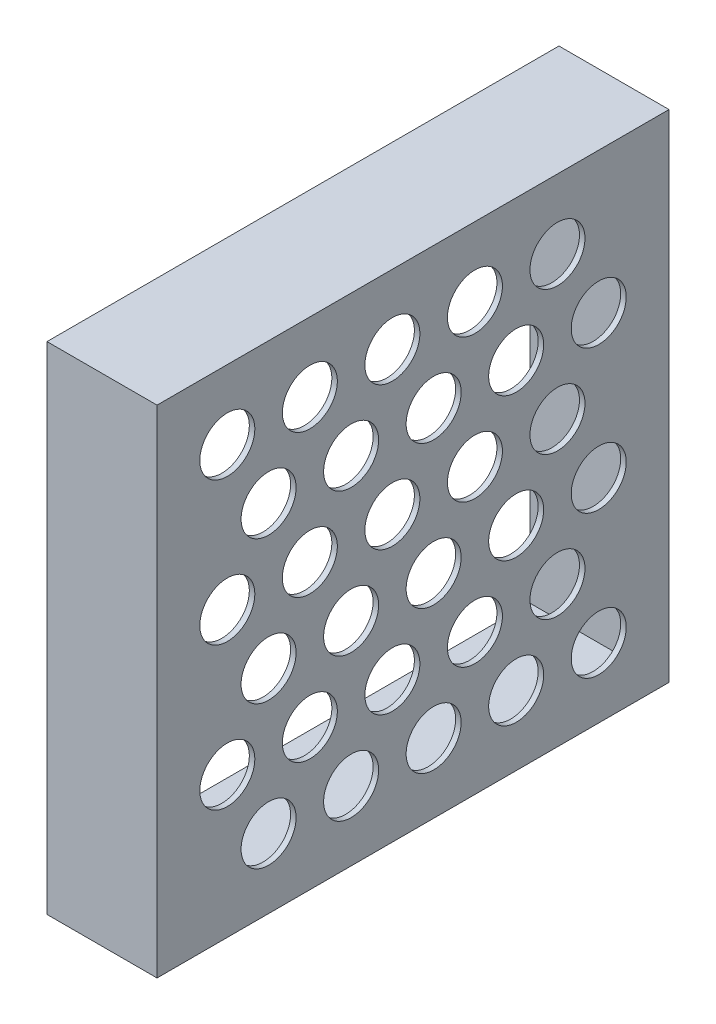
SolidWorks part; units mm, degrees
ref_plane "Front Plane" through (0, 0, 0) normal (0, 0, 1) x (1, 0, 0)
ref_plane "Top Plane" through (0, 0, 0) normal (0, 1, 0) x (1, 0, 0)
ref_plane "Right Plane" through (0, 0, 0) normal (1, 0, 0) x (0, 0, -1)
sketch "Sketch2" plane through (0, 0, 0) normal (1, 0, 0) x (0, 0, -1)
  line L6 (-37.5, 297.3) -> (375, 297.3)
  line L9 (-37.5, 297.3) -> (-37.5, -102.4519)
  line L12 (-37.5, -102.4519) -> (375, -102.4519)
  line L13 (375, 297.3) -> (375, -102.4519)
  line L25 (25, 519.6) -> (50, 519.6)
  line L26 (100, 519.6) -> (125, 519.6)
  line L27 (175, 519.6) -> (200, 519.6)
  line L28 (250, 519.6) -> (275, 519.6)
  line L29 (325, 519.6) -> (350, 519.6)
  line L30 (325, 389.7) -> (350, 389.7)
  line L31 (250, 389.7) -> (275, 389.7)
  line L32 (175, 389.7) -> (200, 389.7)
  line L33 (100, 389.7) -> (125, 389.7)
  line L34 (25, 389.7) -> (50, 389.7)
  line L35 (25, 259.8) -> (50, 259.8)
  line L36 (100, 259.8) -> (125, 259.8)
  line L37 (175, 259.8) -> (200, 259.8)
  line L38 (250, 259.8) -> (275, 259.8)
  line L39 (325, 259.8) -> (350, 259.8)
  line L40 (25, 129.9) -> (50, 129.9)
  line L41 (100, 129.9) -> (125, 129.9)
  line L42 (175, 129.9) -> (200, 129.9)
  line L43 (250, 129.9) -> (275, 129.9)
  line L44 (325, 129.9) -> (350, 129.9)
  line L45 (25, 0) -> (50, 0)
  line L46 (100, 0) -> (125, 0)
  line L47 (175, 0) -> (200, 0)
  line L48 (250, 0) -> (275, 0)
  line L49 (325, 0) -> (350, 0)
  circle A0 centre (0, 0) radius 25
  circle A1 centre (75, 0) radius 25
  circle A2 centre (150, 0) radius 25
  circle A3 centre (225, 0) radius 25
  circle A4 centre (300, 0) radius 25
  circle A5 centre (37.5, -64.9519) radius 25
  circle A6 centre (112.5, -64.9519) radius 25
  circle A7 centre (187.5, -64.9519) radius 25
  circle A8 centre (262.5, -64.9519) radius 25
  circle A9 centre (337.5, -64.9519) radius 25
  circle A10 centre (37.5, 64.9481) radius 25
  circle A11 centre (112.5, 64.9481) radius 25
  circle A12 centre (187.5, 64.9481) radius 25
  circle A13 centre (262.5, 64.9481) radius 25
  circle A14 centre (337.5, 64.9481) radius 25
  circle A15 centre (37.5, 194.8481) radius 25
  circle A16 centre (112.5, 194.8481) radius 25
  circle A17 centre (187.5, 194.8481) radius 25
  circle A18 centre (262.5, 194.8481) radius 25
  circle A19 centre (337.5, 194.8481) radius 25
  circle A30 centre (0, 129.9) radius 25
  circle A31 centre (75, 129.9) radius 25
  circle A32 centre (150, 129.9) radius 25
  circle A33 centre (225, 129.9) radius 25
  circle A34 centre (300, 129.9) radius 25
  circle A35 centre (0, 259.8) radius 25
  circle A36 centre (75, 259.8) radius 25
  circle A37 centre (150, 259.8) radius 25
  circle A38 centre (225, 259.8) radius 25
  circle A39 centre (300, 259.8) radius 25
  circle A50 centre (37.5, 324.7481) radius 25
  circle A51 centre (112.5, 324.7481) radius 25
  circle A52 centre (187.5, 324.7481) radius 25
  circle A53 centre (262.5, 324.7481) radius 25
  circle A54 centre (337.5, 324.7481) radius 25
  circle A55 centre (300, 389.7) radius 25
  circle A56 centre (225, 389.7) radius 25
  circle A57 centre (150, 389.7) radius 25
  circle A58 centre (75, 389.7) radius 25
  circle A59 centre (0, 389.7) radius 25
  circle A60 centre (37.5, 454.6481) radius 25
  circle A61 centre (112.5, 454.6481) radius 25
  circle A62 centre (187.5, 454.6481) radius 25
  circle A63 centre (262.5, 454.6481) radius 25
  circle A64 centre (337.5, 454.6481) radius 25
  circle A65 centre (225, 519.6) radius 25
  circle A66 centre (150, 519.6) radius 25
  circle A67 centre (75, 519.6) radius 25
  circle A68 centre (0, 519.6) radius 25
  circle A69 centre (300, 519.6) radius 25
  dimension "D1" = 5
  dimension "D2" = 75
  dimension "D3" = 75
  dimension "D4" = 5
  dimension "D5" = 5
  dimension "D6" = 5
extrude "Boss-Extrude1" add sketch "Sketch2" along normal blind 5
scale "Scale1" scale about centroid uniform scaling yes scale factor 0.5
sketch "Sketch6" plane through (3.75, 0, 0) normal (1, 0, 0) x (0, 0, -1)
  line L0 (65.625, 197.362) -> (271.875, 197.362)
  line L1 (271.875, 197.362) -> (271.875, -2.5139)
  line L2 (271.875, -2.5139) -> (65.625, -2.5139)
  line L3 (65.625, -2.5139) -> (65.625, 197.362)
  line L4 (65.625, 197.362) -> (271.875, -2.5139)
  line L5 (271.875, 197.362) -> (65.625, -2.5139)
  line L7 (285.0585, -15.29) -> (52.4415, -15.29)
  line L8 (285.0585, -15.29) -> (285.0585, 210.1381)
  line L9 (285.0585, 210.1381) -> (52.4415, 210.1381)
  line L10 (52.4415, -15.29) -> (52.4415, 210.1381)
  line L11 (285.0585, -15.29) -> (52.4415, 210.1381) construction
  line L12 (285.0585, 210.1381) -> (52.4415, -15.29) construction
  point P4 (168.75, 97.424)
extrude "Boss-Extrude7" add sketch "Sketch6" against normal blind 50 contours L10 L7 L8 L9 M16 M19 M18 M17
